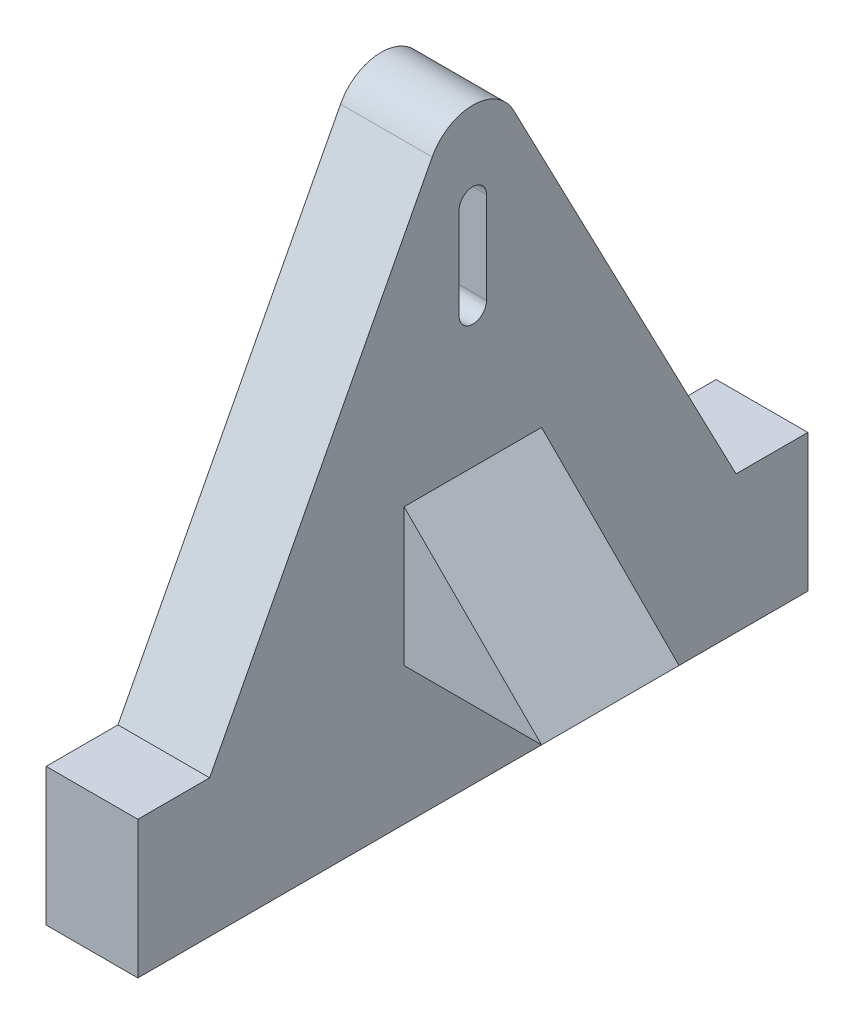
SolidWorks part; units mm, degrees
ref_plane "Front Plane" through (0, 0, 0) normal (0, 0, 1) x (1, 0, 0)
ref_plane "Top Plane" through (0, 0, 0) normal (0, 1, 0) x (1, 0, 0)
ref_plane "Right Plane" through (0, 0, 0) normal (1, 0, 0) x (0, 0, -1)
sketch "Sketch1" plane through (0, 0, 0) normal (1, 0, 0) x (0, 0, -1)
  line L0 (-8.8644, 53.023) -> (-73.0996, -70)
  line L3 (-73.0996, -70) -> (73.0996, -70)
  line L6 (-73.0996, -70) -> (24.3665, 23.3333) construction
  line L7 (8.8644, 53.023) -> (73.0996, -70)
  line L10 (-24.3665, 23.3333) -> (73.0996, -70) construction
  arc A1 (8.8644, 53.023) -> (-8.8644, 53.023) centre (0, 48.3945) ccw
  point P1 (0, 0)
  point P7 (0, -70)
  point P12 (0, 70)
  dimension "D4" = 10
  dimension "D1" = 140
extrude "Boss-Extrude1" add sketch "Sketch1" along normal blind 30 contours L0 L3 L7 A1
sketch "Sketch2" plane through (30, 0, 0) normal (1, 0, 0) x (0, 0, -1)
  line L1 (0, 20) -> (0, 40) construction
  line L2 (-3, 20) -> (-3, 40)
  line L3 (3, 20) -> (3, 40)
  line L4 (-73.0996, -70) -> (73.0996, -70) construction
  arc A1 (-3, 20) -> (3, 20) centre (0, 20) ccw
  arc A2 (3, 40) -> (-3, 40) centre (0, 40) ccw
  point P2 (0, 0)
  point P7 (0, 30)
  dimension "D1" = 100
  dimension "D2" = 20
  dimension "D3" = 6
sketch "Sketch3" plane through (0, -70, 0) normal (0, -1, 0) x (1, 0, 0)
  line L1 (0, 73.0996) -> (30, 73.0996)
  line L2 (0, 73.0996) -> (0, -73.0996)
  line L3 (0, -73.0996) -> (30, -73.0996)
  line L4 (30, 73.0996) -> (30, -73.0996)
extrude "Boss-Extrude2" add sketch "Sketch3" against normal blind 30
extrude "Cut-Extrude3" cut sketch "Sketch2" against normal through all both and the other way through all
sketch "Sketch4" plane through (30, 0, 0) normal (1, 0, 0) x (0, 0, -1)
  line L0 (-57.4354, -40) -> (58.2071, -40) construction
  line L1 (-15, -40) -> (15, -40)
  line L2 (-15, -40) -> (-15, -10)
  line L3 (-15, -10) -> (15, -10)
  line L4 (15, -40) -> (15, -10)
  line L5 (-15, -40) -> (15, -10) construction
  line L6 (-15, -10) -> (15, -40) construction
  point P0 (0, -25)
  point P8 (0, 0)
  dimension "D1" = 30
  dimension "D2" = 30
extrude "Boss-Extrude3" add sketch "Sketch4" along normal blind 30
sketch "Sketch5" plane through (0, 0, -15) normal (0, 0, -1) x (-1, 0, 0)
  line L0 (-60, -40) -> (-30, -10)
  line L1 (-30, -10) -> (-60, -10)
  line L2 (-60, -10) -> (-60, -40)
extrude "Cut-Extrude4" cut sketch "Sketch5" against normal through all both and the other way through all
sketch "Sketch6" plane through (0, 0, -73.0996) normal (0, 0, -1) x (-1, 0, 0)
  line L1 (0, -70) -> (-10, -70)
  line L2 (0, -70) -> (0, 63.2451)
  line L3 (0, 63.2451) -> (-10, 63.2451)
  line L4 (-10, -70) -> (-10, 63.2451)
  dimension "D1" = 10
extrude "Cut-Extrude5" cut sketch "Sketch6" against normal through all both and the other way through all
